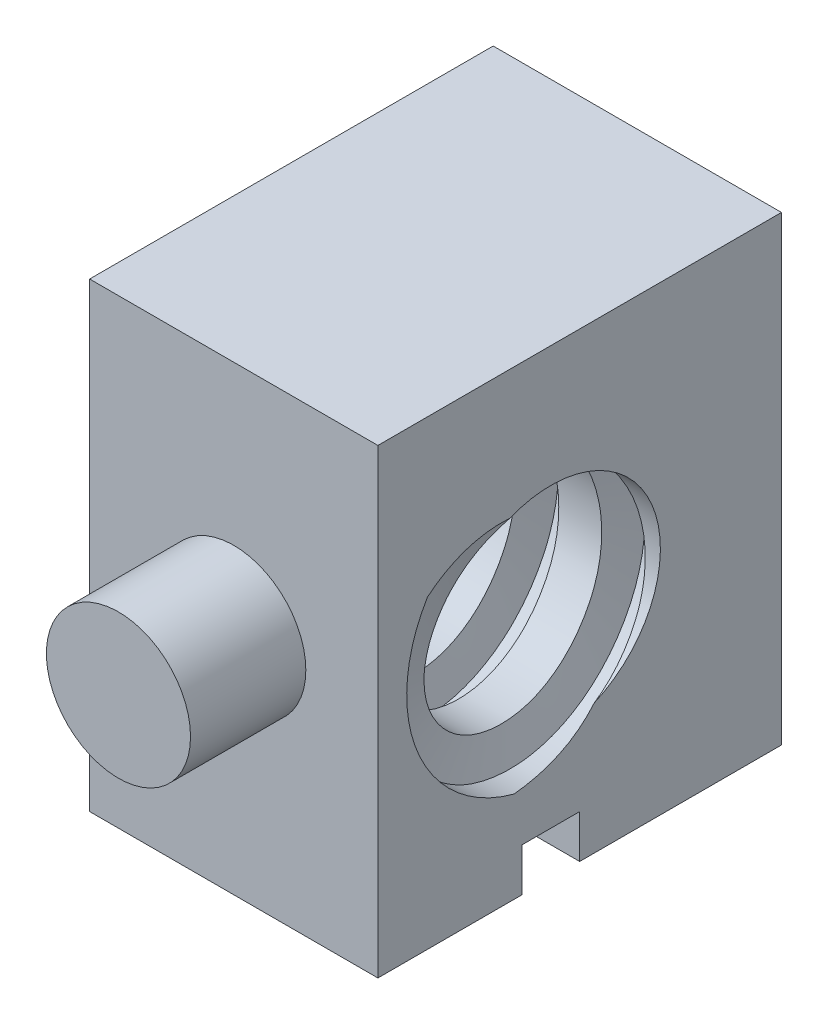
SolidWorks part; units mm, degrees
ref_plane "Front Plane" through (0, 0, 0) normal (0, 0, 1) x (1, 0, 0)
ref_plane "Top Plane" through (0, 0, 0) normal (0, 1, 0) x (1, 0, 0)
ref_plane "Right Plane" through (0, 0, 0) normal (1, 0, 0) x (0, 0, -1)
sketch "Sketch1" plane through (0, 0, 0) normal (1, 0, 0) x (0, 0, -1)
  line L0 (1.27, -10.16) -> (10.16, -10.16)
  line L1 (-10.16, -10.16) -> (-1.27, -10.16)
  line L2 (-10.16, -10.16) -> (-10.16, -1.905)
  line L3 (-10.16, 10.16) -> (10.16, 10.16)
  line L4 (10.16, -10.16) -> (10.16, 10.16)
  line L5 (-1.27, -8.255) -> (1.27, -8.255)
  line L6 (-1.27, -8.255) -> (-1.27, -10.16)
  line L8 (1.27, -8.255) -> (1.27, -10.16)
  line L9 (-10.16, 1.905) -> (-10.16, 10.16)
  line L14 (-10.16, 1.905) -> (-10.16, -1.905)
  dimension "D1" = 20.32
  dimension "D2" = 20.32
  dimension "D3" = 10.16
  dimension "D4" = 10.16
  dimension "D5" = 2.54
  dimension "D6" = 1.905
  dimension "D8" = 8.89
extrude "Boss-Extrude2" add sketch "Sketch1" along normal blind 12.7
sketch "Sketch3" plane through (12.7, 0, 0) normal (1, 0, 0) x (0, 0, -1)
  circle A0 centre (0, 0) radius 4.826
  dimension "D1" = 9.652
extrude "Cut-Extrude2" cut sketch "Sketch3" against normal blind 12.7
sketch "Sketch4" plane through (0, 0, 0) normal (0, 0, 1) x (1, 0, 0)
  line L0 (13.3245, 6.35) -> (12.9304, 4.826)
  line L1 (13.3245, 6.35) -> (14.4544, 6.35)
  line L7 (14.8486, 4.826) -> (14.4544, 6.35)
  line L8 (12.9304, 4.826) -> (14.8486, 4.826)
  dimension "D2" = 1.1299
sketch "Sketch5" plane through (0, 0, 0) normal (0, 0, 1) x (1, 0, 0)
  line L0 (12.7, 0) -> (-177.8, 0)
  line L1 (12.7, 10.16) -> (12.7, -10.16) construction
  dimension "D1" = 190.5
  dimension "D2" = 0
sweep "Cut-Sweep1" cut profiles "Sketch4" path "Sketch5" parameters "D4"=18000
sketch "Sketch9" plane through (0, 0, 10.16) normal (0, 0, 1) x (1, 0, 0)
  line L1 (-2.6232, 12.7324) -> (15.7607, 12.7324)
  line L2 (-2.6232, 12.7324) -> (-2.6232, -13.3042)
  line L3 (-2.6232, -13.3042) -> (15.7607, -13.3042)
  line L4 (15.7607, 12.7324) -> (15.7607, -13.3042)
extrude "Cut-Extrude4" cut sketch "Sketch9" against normal blind 2.54
sketch "Sketch10" plane through (0, 0, 7.62) normal (0, 0, 1) x (1, 0, 0)
  line L0 (0, -10.16) -> (0, 10.16) construction
  line L1 (0, -10.16) -> (12.7, -10.16) construction
  circle A0 centre (6.35, 0) radius 3.175
  dimension "D1" = 6.35
  dimension "D2" = 6.35
  dimension "D3" = 10.16
extrude "Boss-Extrude5" add sketch "Sketch10" along normal blind 5.08
